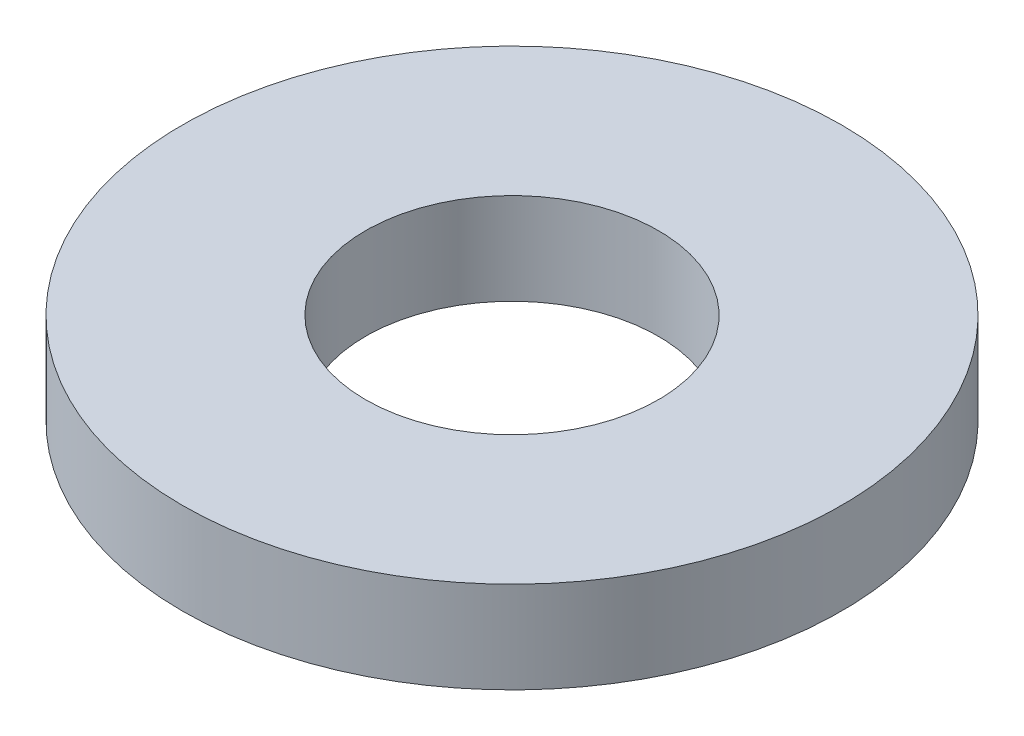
SolidWorks part; units mm, degrees
ref_plane "Front Plane" through (0, 0, 0) normal (0, 0, 1) x (1, 0, 0)
ref_plane "Top Plane" through (0, 0, 0) normal (0, 1, 0) x (1, 0, 0)
ref_plane "Right Plane" through (0, 0, 0) normal (1, 0, 0) x (0, 0, -1)
sketch "Sketch1" plane through (0, 0, 0) normal (0, 1, 0) x (1, 0, 0)
  circle A0 centre (0, 0) radius 18
  circle A1 centre (0, 0) radius 8
  dimension "D1" = 36
  dimension "D2" = 16
extrude "Boss-Extrude1" add sketch "Sketch1" along normal blind 5
